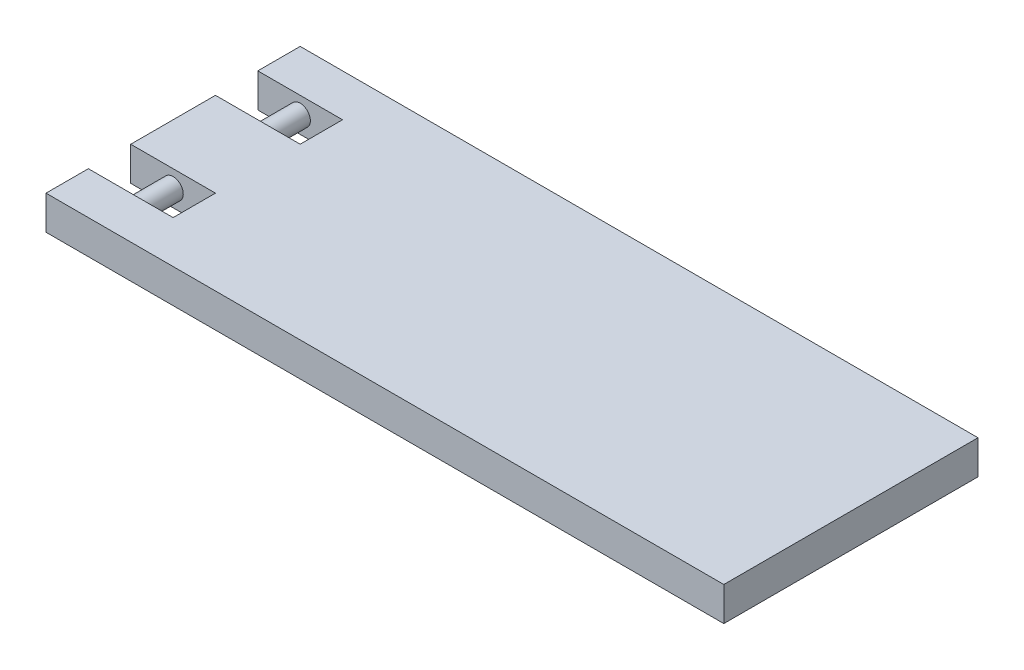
SolidWorks part; units mm, degrees
ref_plane "Piano frontale" through (0, 0, 0) normal (0, 0, 1) x (1, 0, 0)
ref_plane "Piano superiore" through (0, 0, 0) normal (0, 1, 0) x (1, 0, 0)
ref_plane "Piano destro" through (0, 0, 0) normal (1, 0, 0) x (0, 0, -1)
sketch "Schizzo1" plane through (0, 0, 0) normal (0, 1, 0) x (1, 0, 0)
  line L1 (0, 75) -> (400, 75)
  line L2 (0, 75) -> (0, -75)
  line L3 (0, -75) -> (400, -75)
  line L4 (400, 75) -> (400, -75)
  dimension "D1" = 400
  dimension "D2" = 150
extrude "Estrusione1" add sketch "Schizzo1" along normal blind 20
sketch "Schizzo2" plane through (0, 20, 0) normal (0, 1, 0) x (1, 0, 0)
  line L0 (0, 0) -> (400, 0) construction
  line L1 (0, 75) -> (0, -75) construction
  line L2 (400, -75) -> (400, 75) construction
  line L4 (0, 50) -> (50, 50)
  line L5 (0, 50) -> (0, 25)
  line L6 (0, 25) -> (50, 25)
  line L7 (50, 50) -> (50, 25)
  dimension "D1" = 50
  dimension "D2" = 25
  dimension "D3" = 50
extrude "Estrusione2" cut sketch "Schizzo2" against normal through all
ref_plane "Piano1" through (0, 0, 0) normal (0, 0, 1) x (1, 0, 0)
mirror "Specchia1" about plane through (0, 0, 0) normal (0, 0, 1) of "Estrusione2"
sketch "Schizzo3" plane through (0, 0, 75) normal (0, 0, 1) x (1, 0, 0)
  line L0 (0, 10) -> (25, 10) construction
  line L1 (0, 20) -> (0, 0) construction
  line L2 (0, 20) -> (50, 20) construction
  circle A0 centre (25, 10) radius 6
  point P7 (25, 20)
  dimension "D1" = 12
extrude "Boss.-Extru.1" add sketch "Schizzo3" against normal up to surface (150 mm away)
